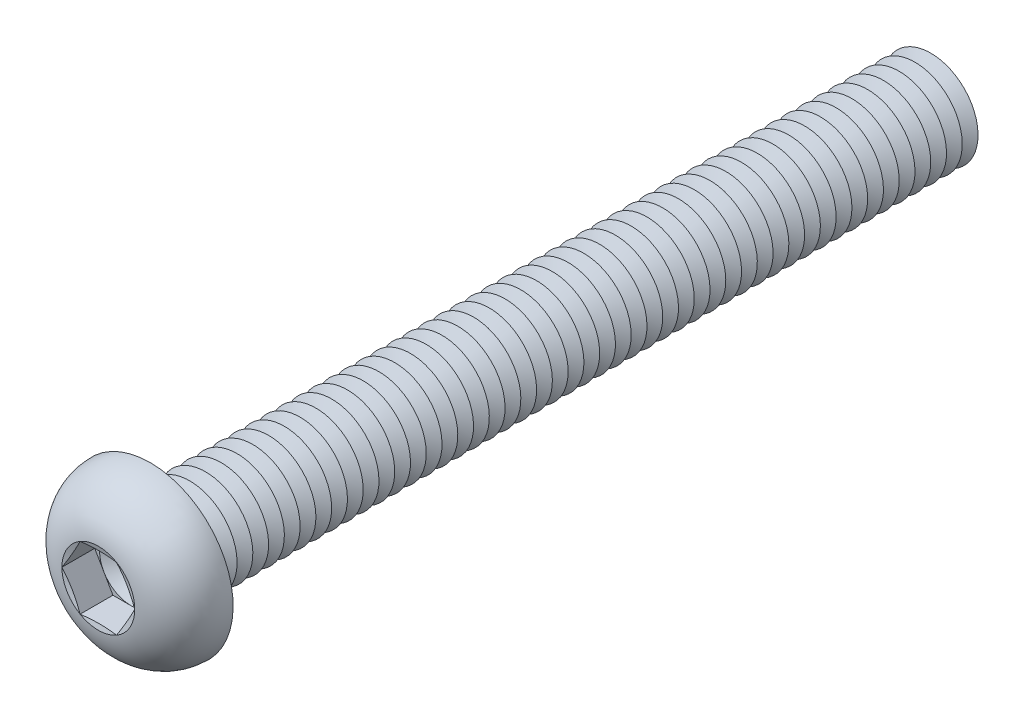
SolidWorks part; units mm, degrees
ref_plane "Front Plane" through (0, 0, 0) normal (0, 0, 1) x (1, 0, 0)
ref_plane "Top Plane" through (0, 0, 0) normal (0, 1, 0) x (1, 0, 0)
ref_plane "Right Plane" through (0, 0, 0) normal (1, 0, 0) x (0, 0, -1)
sketch "Sketch1" plane through (0, 0, 0) normal (1, 0, 0) x (0, 0, -1)
  line L0 (0, 3) -> (0, 5.25)
  line L3 (0, 3) -> (50, 3)
  line L4 (50, 3) -> (50, 0)
  line L5 (50, 0) -> (-3.3, 0) construction
  line L6 (-3.3, 0) -> (50, 0)
  line L7 (-3.3, 2.3094) -> (-3.3, 1.1547) construction
  line L8 (-3.3, 1.1547) -> (-3.3, 0)
  line L9 (-3.3, 2.3094) -> (-2.9906, 1.1547)
  line L10 (-2.9906, 1.1547) -> (-3.3, 1.1547)
  line L11 (50, 0) -> (22.7481, 0) construction
  line L12 (0, 5.25) -> (-3.3, 5.25) construction
  arc A1 (0, 5.25) -> (-3.3, 2.3094) centre (0, 1.928) ccw
  point P8 (50, 1.5)
  dimension "D1" = 10.5
  dimension "D2" = 6
  dimension "D3" = 3.3
  dimension "D4" = 4.6188
  dimension "D5" = 50
  dimension "D6" = 15
revolve "Revolve1" add sketch "Sketch1" angle 360 about L5
fillet "Fillet1" radius 0.5 1 edges at (0, 3, 0)
sketch "Sketch2" plane through (0, 0, 0) normal (1, 0, 0) x (0, 0, -1)
  line L0 (49.5, 3) -> (50.5, 3)
  line L1 (50, 3) -> (0.5, 3) construction
  line L2 (50.5, 3) -> (50, 2.134)
  line L3 (50, -3) -> (50, 3) construction
  line L4 (50, 2.134) -> (49.5, 3)
  dimension "D1" = 1
revolve "Cut-Revolve1" cut sketch "Sketch2" angle 360 about axis through (0, 0, -50) along (0, 0, -1)
pattern_linear "LPattern1" count 50 spacing 1 along (0, 0, 1) of "Cut-Revolve1"
sketch "Sketch3" plane through (0, 0, 3.3) normal (0, 0, 1) x (1, 0, 0)
  line L7 (1.1547, 2) -> (-1.1547, 2)
  line L8 (-1.1547, 2) -> (-2.3094, 0)
  line L9 (-2.3094, 0) -> (-1.1547, -2)
  line L10 (-1.1547, -2) -> (1.1547, -2)
  line L11 (1.1547, -2) -> (2.3094, 0)
  line L12 (2.3094, 0) -> (1.1547, 2)
  circle A0 centre (0, 0) radius 2 construction
  circle A3 centre (0, 0) radius 2.3094 construction
extrude "Cut-Extrude1" cut sketch "Sketch3" against normal blind 2.08
sketch "Sketch4" plane through (0, 0, 1.22) normal (0, 0, 1) x (1, 0, 0)
  line L1 (1.1547, 2) -> (-1.1547, 2) construction
  circle A0 centre (0, 0) radius 2
extrude "Cut-Extrude2" cut sketch "Sketch4" against normal through all draft 60
